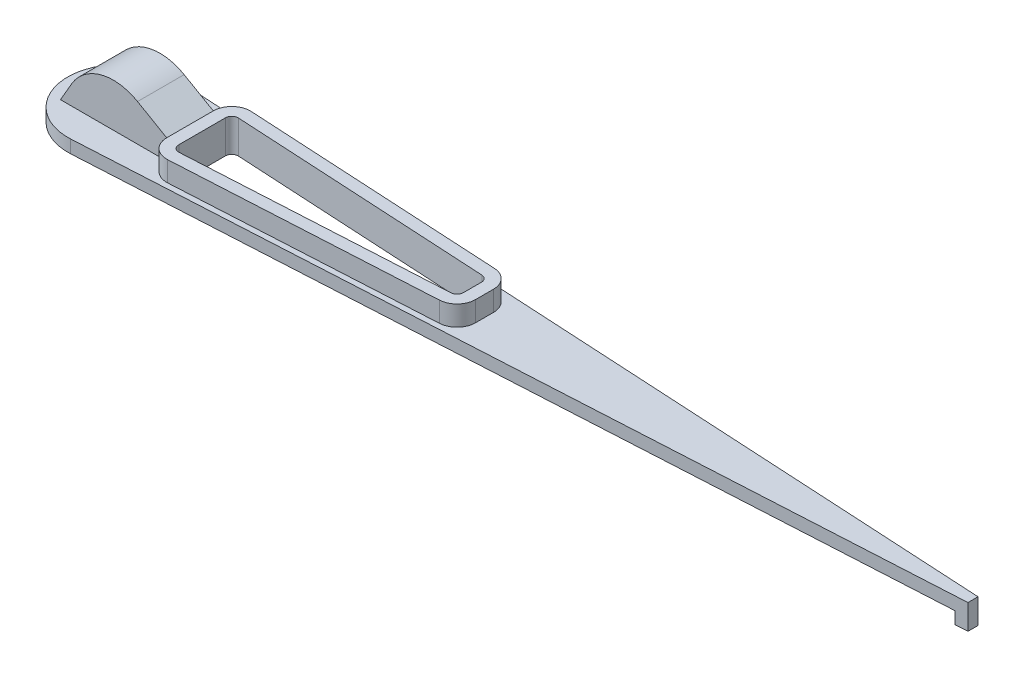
SolidWorks part; units mm, degrees
ref_plane "Front Plane" through (0, 0, 0) normal (0, 0, 1) x (1, 0, 0)
ref_plane "Top Plane" through (0, 0, 0) normal (0, 1, 0) x (1, 0, 0)
ref_plane "Right Plane" through (0, 0, 0) normal (1, 0, 0) x (0, 0, -1)
sketch "Sketch1" plane through (0, 0, 0) normal (0, 1, 0) x (1, 0, 0)
  line L0 (-15.4201, 0) -> (126.556, 0) construction
  line L1 (106, 0.625) -> (106, -0.625)
  line L2 (106, 0.625) -> (0.3603, 6.49)
  line L3 (106, -0.625) -> (0.3603, -6.49)
  arc A0 (0.3603, 6.49) -> (0.3603, -6.49) centre (0, 0) ccw
  dimension "D1" = 13
  dimension "D2" = 106
  dimension "D4" = 0.625
extrude "Extrude1" add sketch "Sketch1" along normal blind 1.6
sketch "Sketch2" plane through (0, 1.6, 0) normal (0, 1, 0) x (1, 0, 0)
  line L0 (8, 2.8947) -> (8, -2.8947) construction
  line L1 (46, 1.1181) -> (46, -1.1181) construction
  line L2 (0.3603, -6.49) -> (106, -0.625) construction
  line L3 (106, 0.625) -> (0.3603, 6.49) construction
  line L4 (11.1663, -5.8901) -> (43.1663, -4.1135) construction
  line L5 (43.1663, 4.1135) -> (11.1663, 5.8901) construction
  line L6 (8.7, 2.8947) -> (8.7, -2.8947)
  line L7 (11.1275, -5.1911) -> (43.1275, -3.4145)
  line L8 (45.3, 1.1181) -> (45.3, -1.1181)
  line L9 (43.1275, 3.4145) -> (11.1275, 5.1911)
  arc A0 (8, 2.8947) -> (11.1663, 5.8901) centre (11, 2.8947) cw construction
  arc A1 (11.1663, -5.8901) -> (8, -2.8947) centre (11, -2.8947) cw construction
  arc A2 (46, -1.1181) -> (43.1663, -4.1135) centre (43, -1.1181) cw construction
  arc A3 (43.1663, 4.1135) -> (46, 1.1181) centre (43, 1.1181) cw construction
  arc A4 (11.1275, -5.1911) -> (8.7, -2.8947) centre (11, -2.8947) cw
  arc A5 (45.3, -1.1181) -> (43.1275, -3.4145) centre (43, -1.1181) cw
  arc A6 (43.1275, 3.4145) -> (45.3, 1.1181) centre (43, 1.1181) cw
  arc A7 (8.7, 2.8947) -> (11.1275, 5.1911) centre (11, 2.8947) cw
  dimension "D3" = 3
  dimension "D4" = 3
  dimension "D1" = 38
  dimension "D2" = 8
  dimension "D5" = 0.7
extrude "Extrude2" add sketch "Sketch2" along normal blind 2.5
sketch "Sketch5" plane through (0, 4.1, 0) normal (0, 1, 0) x (1, 0, 0)
  line L8 (10.2, 2.8947) -> (10.2, -2.8947)
  line L9 (11.0443, -3.6935) -> (43.0443, -1.9168)
  line L10 (43.8, -1.1181) -> (43.8, 1.1181)
  line L11 (43.0443, 1.9168) -> (11.0443, 3.6935)
  line L12 (10.2, 2.8947) -> (10.2, -2.8947)
  line L13 (11.0443, -3.6935) -> (43.0443, -1.9168)
  line L14 (43.8, -1.1181) -> (43.8, 1.1181)
  line L15 (43.0443, 1.9168) -> (11.0443, 3.6935)
  arc A8 (11.0443, 3.6935) -> (10.2, 2.8947) centre (11, 2.8947) ccw
  arc A9 (10.2, -2.8947) -> (11.0443, -3.6935) centre (11, -2.8947) ccw
  arc A10 (43.0443, -1.9168) -> (43.8, -1.1181) centre (43, -1.1181) ccw
  arc A11 (43.8, 1.1181) -> (43.0443, 1.9168) centre (43, 1.1181) ccw
  arc A12 (11.0443, 3.6935) -> (10.2, 2.8947) centre (11, 2.8947) ccw
  arc A13 (10.2, -2.8947) -> (11.0443, -3.6935) centre (11, -2.8947) ccw
  arc A14 (43.0443, -1.9168) -> (43.8, -1.1181) centre (43, -1.1181) ccw
  arc A15 (43.8, 1.1181) -> (43.0443, 1.9168) centre (43, 1.1181) ccw
  dimension "D1" = 1.5
extrude "Extrude6" cut sketch "Sketch5" against normal through all
sketch "Sketch6" plane through (0, 0, 0) normal (0, 0, -1) x (1, 0, 0)
  line L0 (-6.5, -1.6) -> (0.3603, -1.6) construction
  line L1 (106, -1.6) -> (0.3603, -1.6) construction
  line L2 (8.7, -4.1) -> (8.7, -1.6) construction
  line L3 (-4.5, -1.6) -> (0.3603, -1.6)
  line L4 (8.7, -1.6) -> (0.3603, -1.6)
  line L5 (8.7, -4.1) -> (8.7, -1.6)
  line L6 (8.7, -4.1) -> (-0.1175, -9.1908)
  line L7 (-0.1175, -9.1908) -> (-4.5, -1.6)
  dimension "D1" = 2
  dimension "D2" = 60
extrude "Extrude7" add sketch "Sketch6" along normal up to vertex (2.8947 mm away) and the other way up to vertex (2.8947 mm away)
fillet "Fillet1" radius 6 1 edges at (-0.1175, 9.1908, 0)
sketch "Sketch4" plane through (0, 0, 0) normal (0, -1, 0) x (-1, 0, 0)
  circle A0 centre (0, 0) radius 5
  dimension "D1" = 10
extrude "Extrude4" add sketch "Sketch4" along normal blind 1
sketch "Sketch7" plane through (0, 0, 0) normal (0, -1, 0) x (-1, 0, 0)
  line L0 (-104.5, 0.7083) -> (-104.5, -0.7083)
  line L1 (-106, -0.625) -> (-106, 0.625) construction
  line L2 (-0.3603, -6.49) -> (-106, -0.625) construction
  line L3 (-106, 0.625) -> (-0.3603, 6.49) construction
  line L4 (-106, -0.625) -> (-106, 0.625)
  line L5 (-104.5, -0.7083) -> (-106, -0.625)
  line L6 (-106, 0.625) -> (-104.5, 0.7083)
  dimension "D1" = 1.5
extrude "Extrude8" add sketch "Sketch7" along normal blind 1.5
